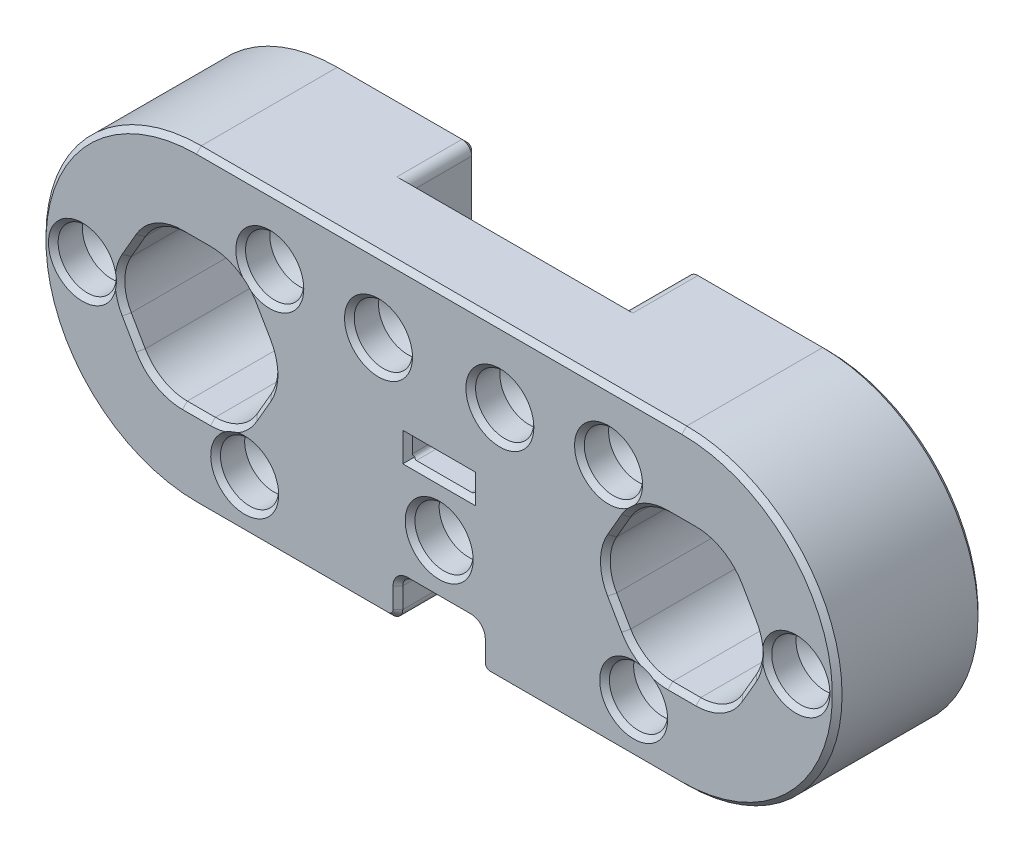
SolidWorks part; units mm, degrees
ref_plane "Płaszczyzna przednia" through (0, 0, 0) normal (0, 0, 1) x (1, 0, 0)
ref_plane "Płaszczyzna górna" through (0, 0, 0) normal (0, 1, 0) x (1, 0, 0)
ref_plane "Płaszczyzna prawa" through (0, 0, 0) normal (1, 0, 0) x (0, 0, -1)
sketch "Szkic1" plane through (0, 0, 0) normal (0, 0, 1) x (1, 0, 0)
  line L0 (25, 12.2819) -> (25, -8.7728) construction
  line L1 (4.3301, 7.5) -> (-4.3301, 7.5)
  line L2 (-4.3301, 7.5) -> (-8.6603, 0)
  line L3 (-8.6603, 0) -> (-4.3301, -7.5)
  line L4 (-4.3301, -7.5) -> (4.3301, -7.5)
  line L5 (4.3301, -7.5) -> (8.6603, 0)
  line L6 (8.6603, 0) -> (4.3301, 7.5)
  line L7 (41.3397, 0) -> (45.6699, 7.5)
  line L8 (45.6699, -7.5) -> (41.3397, 0)
  line L9 (54.3301, -7.5) -> (45.6699, -7.5)
  line L10 (58.6603, 0) -> (54.3301, -7.5)
  line L11 (54.3301, 7.5) -> (58.6603, 0)
  line L12 (45.6699, 7.5) -> (54.3301, 7.5)
  line L13 (0, 0) -> (50, 0) construction
  line L14 (22, 6.5) -> (28, 6.5) construction
  line L15 (22, 6.5) -> (22, -6.5) construction
  line L16 (22, -6.5) -> (28, -6.5) construction
  line L17 (28, 6.5) -> (28, -6.5) construction
  line L18 (0, 16) -> (50, 16)
  line L19 (0, -16) -> (50, -16)
  circle A0 centre (0, 0) radius 7.5 construction
  circle A1 centre (50, 0) radius 7.5 construction
  arc A2 (0, 16) -> (0, -16) centre (0, 0) ccw
  arc A3 (50, -16) -> (50, 16) centre (50, 0) ccw
  point P23 (25, 6.5)
  point P24 (22, 0)
  point P25 (25, 0)
  dimension "D1" = 15
  dimension "D2" = 50
  dimension "D3" = 6
  dimension "D4" = 13
  dimension "D5" = 32
extrude "Dodanie-wyciągnięcie1" add sketch "Szkic1" along normal blind 15
sketch "Szkic2" plane through (0, 0, 15) normal (0, 0, 1) x (1, 0, 0)
  line L0 (25, 16) -> (25, -16) construction
  line L1 (50, 16) -> (0, 16) construction
  line L2 (0, -16) -> (50, -16) construction
  line L3 (10.4299, -9.6705) -> (20.8592, -9.6705) construction
  line L4 (21.75, -1) -> (28.25, -1)
  line L5 (21.75, -1) -> (21.75, 1)
  line L6 (21.75, 1) -> (28.25, 1)
  line L7 (28.25, -1) -> (28.25, 1)
  line L12 (13.0068, -0.38) -> (13.0068, -13.38) construction
  line L13 (21.75, -11.88) -> (28.25, -11.88)
  line L14 (21.75, -11.88) -> (21.75, -16)
  line L15 (21.75, -16) -> (28.25, -16)
  line L16 (28.25, -11.88) -> (28.25, -16)
  line L17 (13.0068, -13.38) -> (13.0068, -14.76) construction
  arc A0 (50, -16) -> (50, 16) centre (50, 0) ccw construction
  point P10 (25, -1)
  point P11 (28.25, 0)
  point P15 (66, 0)
  point P24 (25, -11.88)
  dimension "D1" = 6.5
  dimension "D2" = 2
  dimension "D3" = 13
  dimension "D4" = 1.38
  dimension "D5" = 1.38
  dimension "D6" = 1.5
extrude "Wytnij-wyciągnięcie1" cut sketch "Szkic2" against normal through all
fillet "Zaokrąglenie1" radius 5 12 edges at (41.3397, 0, 7.5) (45.6699, 7.5, 7.5) (54.3301, 7.5, 7.5) (58.6603, 0, 7.5) (54.3301, -7.5, 7.5) (45.6699, -7.5, 7.5) (-4.3301, -7.5, 7.5) (-8.6603, 0, 7.5) (-4.3301, 7.5, 7.5) (4.3301, 7.5, 7.5) (8.6603, 0, 7.5) (4.3301, -7.5, 7.5)
sketch "Szkic3" plane through (0, 0, 0) normal (0, 0, -1) x (-1, 0, 0)
  line L0 (0, -16) -> (-21.75, -16) construction
  line L1 (-21.75, -11.88) -> (-20.75, -11.88)
  line L2 (-21.75, -11.88) -> (-21.75, -16)
  line L3 (-21.75, -16) -> (-20.75, -16)
  line L4 (-20.75, -11.88) -> (-20.75, -16)
  line L5 (-25, -11.88) -> (-25, -21.2725) construction
  line L6 (-28.25, -11.88) -> (-21.75, -11.88) construction
  line L7 (-29.25, -11.88) -> (-29.25, -16)
  line L8 (-28.25, -16) -> (-29.25, -16)
  line L9 (-28.25, -11.88) -> (-28.25, -16)
  line L10 (-28.25, -11.88) -> (-29.25, -11.88)
  dimension "D1" = 1
extrude "Wytnij-wyciągnięcie2" cut sketch "Szkic3" against normal through all
sketch "Szkic4" plane through (0, 0, 0) normal (0, 0, -1) x (-1, 0, 0)
  line L0 (-28.25, -1) -> (-28.25, 1) construction
  line L1 (-28.25, 3.4) -> (-21.75, 3.4)
  line L2 (-28.25, 3.4) -> (-28.25, 2.2)
  line L3 (-28.25, 2.2) -> (-21.75, 2.2)
  line L4 (-21.75, 3.4) -> (-21.75, 2.2)
  line L5 (-21.75, 1) -> (-21.75, -1) construction
  line L6 (-28.25, 1) -> (-21.75, 1) construction
  line L7 (-21.461, 3.8) -> (-8.8908, 3.8) construction
  line L8 (-21.75, 4.2) -> (-21.75, 5.4)
  line L9 (-28.25, 5.4) -> (-21.75, 5.4)
  line L10 (-28.25, 4.2) -> (-28.25, 5.4)
  line L11 (-28.25, 4.2) -> (-21.75, 4.2)
  line L12 (-22.9774, 5.8) -> (-9.2612, 5.8) construction
  line L13 (-28.25, 7.4) -> (-21.75, 7.4)
  line L14 (-28.25, 7.4) -> (-28.25, 6.2)
  line L15 (-28.25, 6.2) -> (-21.75, 6.2)
  line L16 (-21.75, 7.4) -> (-21.75, 6.2)
  line L17 (-21.75, 8.2) -> (-21.75, 9.4)
  line L18 (-28.25, 9.4) -> (-21.75, 9.4)
  line L19 (-28.25, 8.2) -> (-28.25, 9.4)
  line L20 (-28.25, 8.2) -> (-21.75, 8.2)
  line L21 (-20.7586, 9.8) -> (-9.8732, 9.8) construction
  line L22 (-28.25, 11.4) -> (-21.75, 11.4)
  line L23 (-28.25, 11.4) -> (-28.25, 10.2)
  line L24 (-28.25, 10.2) -> (-21.75, 10.2)
  line L25 (-21.75, 11.4) -> (-21.75, 10.2)
  line L26 (-21.75, 12.2) -> (-21.75, 13.4)
  line L27 (-28.25, 13.4) -> (-21.75, 13.4)
  line L28 (-28.25, 12.2) -> (-28.25, 13.4)
  line L29 (-28.25, 12.2) -> (-21.75, 12.2)
  line L30 (-28.25, 15.4) -> (-21.75, 15.4)
  line L31 (-28.25, 15.4) -> (-28.25, 14.2)
  line L32 (-28.25, 14.2) -> (-21.75, 14.2)
  line L33 (-21.75, 15.4) -> (-21.75, 14.2)
  dimension "D1" = 1.2
  dimension "D2" = 1.2
  dimension "D3" = 0.8
  dimension "D4" = 0.8
  dimension "D5" = 0.8
extrude "Wytnij-wyciągnięcie3" cut sketch "Szkic4" against normal blind 8
sketch "Szkic6" plane through (0, 0, 0) normal (0, 0, -1) x (-1, 0, 0)
  line L0 (-29.25, -11.88) -> (-20.75, -11.88) construction
  line L1 (-25, -1) -> (-25, -11.88) construction
  line L2 (-21.75, -1) -> (-28.25, -1) construction
  line L3 (0, 0) -> (-4.9658, -10.6491) construction
  line L9 (0, 0) -> (11.75, 0) construction
  line L10 (0, 0) -> (-7.5528, 9.001) construction
  circle A0 centre (-25, -6.44) radius 1.7
  circle A1 centre (-25, -6.44) radius 3 construction
  circle A4 centre (-7.5528, 9.001) radius 1.7
  circle A5 centre (11.75, 0) radius 1.7
  circle A6 centre (-7.5528, 9.001) radius 3 construction
  circle A7 centre (0, 0) radius 11.75 construction
  circle A8 centre (-61.75, 0) radius 1.7
  circle A9 centre (-42.4472, 9.001) radius 1.7
  circle A10 centre (-4.9658, -10.6491) radius 1.7
  circle A11 centre (-45.0342, -10.6491) radius 1.7
  point P5 (-25, -11.88)
  point P11 (-25, -6.44)
  dimension "D1" = 3.4
  dimension "D2" = 6
  dimension "D3" = 3.4
  dimension "D4" = 6
  dimension "D5" = 130
  dimension "D6" = 11.75
  dimension "D7" = 115
extrude "Wytnij-wyciągnięcie4" cut sketch "Szkic6" against normal through all
sketch "Szkic7" plane through (0, 0, 0) normal (0, 0, -1) x (-1, 0, 0)
  line L0 (-50, 16) -> (0, 16) construction
  line L1 (-28.25, 1) -> (-21.75, 1)
  line L2 (-28.25, 1) -> (-28.25, 16)
  line L3 (-28.25, 16) -> (-21.75, 16)
  line L4 (-21.75, 1) -> (-21.75, 16)
  line L5 (-21.75, 14.2) -> (-21.75, 15.4) construction
extrude "Wytnij-wyciągnięcie5" cut sketch "Szkic7" against normal blind 7.2
sketch "Szkic8" plane through (0, 0, 0) normal (0, 0, -1) x (-1, 0, 0)
  line L0 (-31.25, 8.5) -> (-18.75, 8.5) construction
  line L1 (-21.75, 16) -> (-28.25, 16) construction
  line L2 (-28.25, -1) -> (-28.25, 16) construction
  line L3 (-25, 16) -> (-25, 1) construction
  line L4 (-28.25, 1) -> (-21.75, 1) construction
  circle A0 centre (-31.25, 8.5) radius 1.7
  circle A1 centre (-18.75, 8.5) radius 1.7
  circle A2 centre (-31.25, 8.5) radius 3 construction
  point P2 (-25, 8.5)
  point P5 (-25, 16)
  point P15 (-25, 8.5)
  dimension "D1" = 3.4
  dimension "D2" = 6
extrude "Wytnij-wyciągnięcie6" cut sketch "Szkic8" against normal through all
sketch "Szkic9" plane through (0, 0, 0) normal (0, 0, -1) x (-1, 0, 0)
  line L0 (-36.15, 16) -> (-36.15, 7.8469)
  line L1 (-36.15, 7.8469) -> (-30.65, 3.2318)
  line L2 (-30.65, 3.2318) -> (-30.65, -1)
  line L3 (-30.65, -1) -> (-19.35, -1)
  line L4 (-21.75, -1) -> (-28.25, -1) construction
  line L5 (-50, 16) -> (-28.25, 16) construction
  line L7 (-36.15, 16) -> (-13.85, 16)
  line L8 (-21.75, 16) -> (-28.25, 16) construction
  line L9 (-25, 16) -> (-25, -1) construction
  line L10 (-19.35, 3.2318) -> (-19.35, -1)
  line L11 (-13.85, 7.8469) -> (-19.35, 3.2318)
  line L12 (-13.85, 16) -> (-13.85, 7.8469)
  circle A0 centre (-31.25, 8.5) radius 2.35 construction
  circle A1 centre (-18.75, 8.5) radius 2.35 construction
  point P8 (-25, -1)
  dimension "D2" = 4.7
  dimension "D1" = 130
  dimension "D3" = 22.3
  dimension "D4" = 11.3
  dimension "D5" = 1.3
extrude "Wytnij-wyciągnięcie7" cut sketch "Szkic9" against normal up to surface (7.2 mm away)
fillet "Zaokrąglenie2" radius 1 1 edges at (25, 1, 7.2)
fillet "Zaokrąglenie3" radius 1 12 edges at (13.85, 7.8469, 3.6) (19.35, 3.2318, 3.6) (19.35, -1, 3.6) (30.65, -1, 3.6) (30.65, 3.2318, 3.6) (36.15, 7.8469, 3.6) (36.15, 16, 3.6) (13.85, 16, 3.6) (20.75, -16, 7.5) (20.75, -11.88, 7.5) (29.25, -16, 7.5) (29.25, -11.88, 7.5)
hole_wizard "Otwór Ø6.0 (6)1" positions "Szkic11" profile "Szkic12" hole size "Ø6.0" standard "DIN"
sketch "Szkic11" plane through (0, 0, 15) normal (0, 0, 1) x (1, 0, 0)
  point P0 (7.5528, 9.001)
  point P3 (18.75, 8.5)
  point P6 (31.25, 8.5)
  point P9 (42.4472, 9.001)
  point P12 (61.75, 0)
  point P15 (25, -6.44)
  point P18 (-11.75, 0)
  point P21 (4.9658, -10.6491)
  point P25 (45.0342, -10.6491)
sketch "Szkic12" plane through (7.5528, 9.001, 15) normal (1, 0, 0) x (0, -1, 0)
  line L0 (0, 0) -> (0, 4.8026)
  line L1 (0, 4.8026) -> (3, 3)
  line L2 (3, 3) -> (3, 0)
  line L5 (3, 0) -> (0, 0)
  line L10 (0, 4.8026) -> (-3, 3) construction
  line L11 (0, -6.35) -> (0, 107.95) construction
  dimension "Średnica otworu" = 6
  dimension "Głębokość otworu" = 3
  dimension "Kąt wiertła" = 118
chamfer "Sfazowanie1" distance 0.5 angle 45 108 edges at (-6.4952, -3.75, 15) (0, -7.5, 0) (0, -7.5, 15) (-6.4952, 3.75, 0) (-6.4952, 3.75, 15) (0, 7.5, 0) (0, 7.5, 15) (6.4952, 3.75, 0) (6.4952, 3.75, 15) (6.4952, -3.75, 0) (6.4952, -3.75, 15) (42.1132, 0, 0) (42.1132, 0, 15) (46.0566, 6.8301, 0) (46.0566, 6.8301, 15) (53.9434, 6.8301, 0) (53.9434, 6.8301, 15) (57.8868, 0, 0) (57.8868, 0, 15) (53.9434, -6.8301, 0) (53.9434, -6.8301, 15) (46.0566, -6.8301, 0) (46.0566, -6.8301, 15) (-3.9434, -6.8301, 0) (-3.9434, -6.8301, 15) (-7.8868, 0, 0) (-7.8868, 0, 15) (-3.9434, 6.8301, 0) (-3.9434, 6.8301, 15) (3.9434, 6.8301, 0) (3.9434, 6.8301, 15) (7.8868, 0, 0) (7.8868, 0, 15) (3.9434, -6.8301, 0) (3.9434, -6.8301, 15) (66, 0, 15) (25, 16, 15) (63.45, 0, 0) (-13.45, 0, 0) (5.8528, 9.001, 0) (3.2658, -10.6491, 0) (44.1472, 9.001, 0) (46.7342, -10.6491, 0) (23.3, -6.44, 0) (-16, 0, 15) (43.575, 16, 0) (66, 0, 0) (20.75, -13.94, 0) (20.75, -13.94, 15) (33.4, 5.5393, 0) (36.15, 11.6566, 0) (40.125, -16, 0) (29.25, -13.94, 0) (25, -11.88, 0) (6.425, 16, 0) (13.85, 11.6566, 0) (16.6, 5.5393, 0) (19.35, 1.3827, 0) (25, -1, 0) (30.65, 1.3827, 0) (13.5571, 15.7071, 0) (36.4429, 15.7071, 0) (30.7437, 3.1881, 0) (19.2563, 3.1881, 0) (29.5429, -15.7071, 0) (20.4571, -15.7071, 0) (25, -11.88, 15) (29.25, -13.94, 15) (40.125, -16, 15) (29.5429, -15.7071, 15) (20.4571, -15.7071, 15) (9.875, -16, 0) (13.9437, 7.8905, 0) (19.6429, -0.7071, 0) (30.3571, -0.7071, 0) (36.0563, 7.8905, 0) (21.0429, -12.1729, 0) (21.0429, -12.1729, 15) (28.9571, -12.1729, 0) (28.9571, -12.1729, 15) (-16, 0, 0) (21.75, 0, 15) (25, -1, 15) (48.0342, -10.6491, 15) (28.25, 0, 15) (25, 1, 15) (7.9658, -10.6491, 15) (-8.75, 0, 15) (28, -6.44, 15) (64.75, 0, 15) (45.4472, 9.001, 15) (34.25, 8.5, 15) (21.75, 8.5, 15) (10.5528, 9.001, 15) (43.5048, 3.75, 0) (43.5048, 3.75, 15) (43.5048, -3.75, 0) (43.5048, -3.75, 15) (9.875, -16, 15) (50, 7.5, 0) (50, 7.5, 15) (56.4952, 3.75, 0) (56.4952, 3.75, 15) (56.4952, -3.75, 0) (56.4952, -3.75, 15) (50, -7.5, 0) (50, -7.5, 15) (-6.4952, -3.75, 0)
fillet "Zaokrąglenie4" radius 0.4 2 edges at (28.25, -1, 10.85) (21.75, -1, 10.85)
